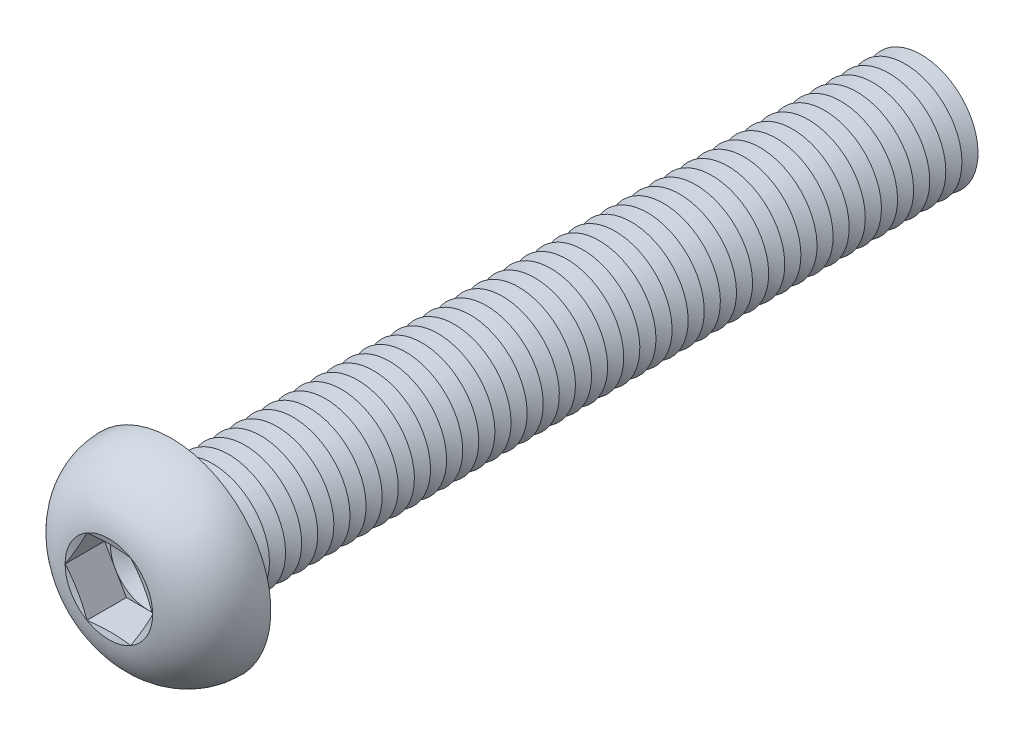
SolidWorks part; units mm, degrees
ref_plane "Front Plane" through (0, 0, 0) normal (0, 0, 1) x (1, 0, 0)
ref_plane "Top Plane" through (0, 0, 0) normal (0, 1, 0) x (1, 0, 0)
ref_plane "Right Plane" through (0, 0, 0) normal (1, 0, 0) x (0, 0, -1)
sketch "Sketch1" plane through (0, 0, 0) normal (1, 0, 0) x (0, 0, -1)
  line L0 (0, 6) -> (0, 10.5)
  line L3 (0, 6) -> (80, 6)
  line L4 (80, 6) -> (80, 0)
  line L5 (80, 0) -> (-6.6, 0) construction
  line L6 (-6.6, 0) -> (80, 0)
  line L7 (-6.6, 4.6188) -> (-6.6, 2.3094) construction
  line L8 (-6.6, 2.3094) -> (-6.6, 0)
  line L9 (-6.6, 4.6188) -> (-5.9812, 2.3094)
  line L10 (-5.9812, 2.3094) -> (-6.6, 2.3094)
  line L11 (80, 0) -> (22.7481, 0) construction
  line L12 (0, 10.5) -> (-6.6, 10.5) construction
  arc A1 (0, 10.5) -> (-6.6, 4.6188) centre (0, 3.8561) ccw
  point P8 (80, 3)
  dimension "D1" = 21
  dimension "D2" = 12
  dimension "D3" = 6.6
  dimension "D4" = 9.2376
  dimension "D5" = 80
  dimension "D6" = 15
revolve "Revolve1" add sketch "Sketch1" angle 360 about L5
fillet "Fillet1" radius 0.85 1 edges at (0, 6, 0)
sketch "Sketch2" plane through (0, 0, 0) normal (1, 0, 0) x (0, 0, -1)
  line L0 (79.15, 6) -> (80.85, 6)
  line L1 (80, 6) -> (0.85, 6) construction
  line L2 (80.85, 6) -> (80, 4.5278)
  line L3 (80, -6) -> (80, 6) construction
  line L4 (80, 4.5278) -> (79.15, 6)
  dimension "D1" = 1.7
revolve "Cut-Revolve1" cut sketch "Sketch2" angle 360 about axis through (0, 0, -80) along (0, 0, -1)
pattern_linear "LPattern1" count 47 spacing 1.7 along (0, 0, 1) of "Cut-Revolve1"
sketch "Sketch3" plane through (0, 0, 6.6) normal (0, 0, 1) x (1, 0, 0)
  line L7 (2.3094, 4) -> (-2.3094, 4)
  line L8 (-2.3094, 4) -> (-4.6188, 0)
  line L9 (-4.6188, 0) -> (-2.3094, -4)
  line L10 (-2.3094, -4) -> (2.3094, -4)
  line L11 (2.3094, -4) -> (4.6188, 0)
  line L12 (4.6188, 0) -> (2.3094, 4)
  circle A0 centre (0, 0) radius 4 construction
  circle A3 centre (0, 0) radius 4.6188 construction
extrude "Cut-Extrude1" cut sketch "Sketch3" against normal blind 4.16
sketch "Sketch4" plane through (0, 0, 2.44) normal (0, 0, 1) x (1, 0, 0)
  line L1 (2.3094, 4) -> (-2.3094, 4) construction
  circle A0 centre (0, 0) radius 4
extrude "Cut-Extrude2" cut sketch "Sketch4" against normal through all draft 60
